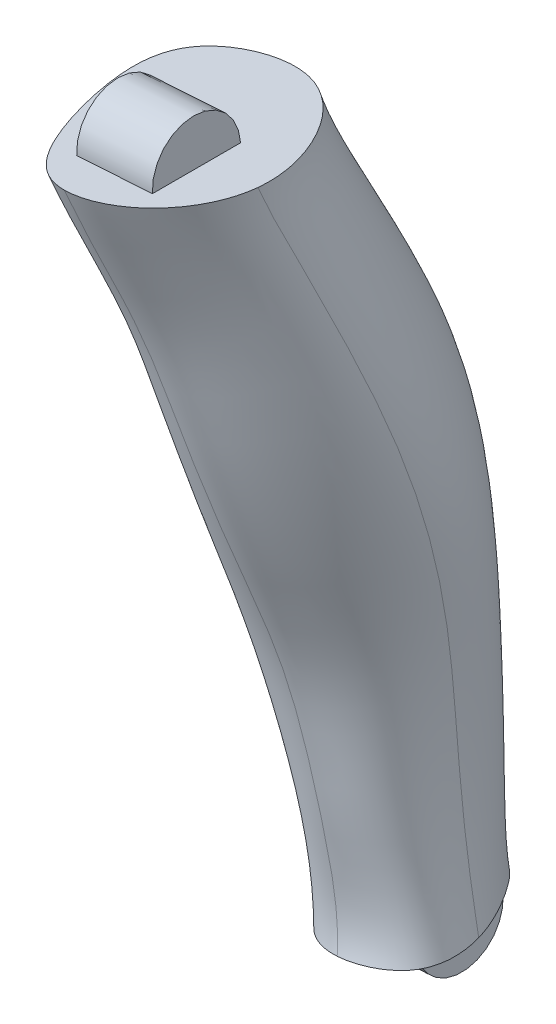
SolidWorks part; units mm, degrees
ref_plane "Front Plane" through (0, 0, 0) normal (0, 0, 1) x (1, 0, 0)
ref_plane "Top Plane" through (0, 0, 0) normal (0, 1, 0) x (1, 0, 0)
ref_plane "Right Plane" through (0, 0, 0) normal (1, 0, 0) x (0, 0, -1)
imported_body "Stock-Source-1"
ref_plane "Plane1" through (0, 0, 88.9) normal (0, 0, 1) x (1, 0, 0)
sketch "Sketch1" plane through (0, 0, 88.9) normal (0, 0, 1) x (1, 0, 0)
  line L0 (130.8768, 3248.3735) -> (174.4954, 3251.1744)
  line L1 (145.3171, 3249.3008) -> (116.4365, 3247.4462) construction
  line L2 (203.6736, 3253.0481) -> (145.3171, 3249.3008) construction
  line L3 (174.4954, 3251.1744) -> (172.8677, 3276.5222)
  line L4 (172.8677, 3276.5222) -> (129.2491, 3273.7213)
  line L5 (129.2491, 3273.7213) -> (130.8768, 3248.3735)
  dimension "D1" = 25.4
revolve "Revolve1" add sketch "Sketch1" angle 360 about L0
sketch "Sketch2" plane through (0, 0, 0) normal (0, 0, 1) x (1, 0, 0)
  line L0 (205.2259, 2860.8871) -> (236.8517, 2862.7863)
  line L1 (205.2259, 2860.8871) -> (206.7485, 2835.5328)
  line L2 (236.8517, 2862.7863) -> (238.3743, 2837.432)
  line L3 (206.7485, 2835.5328) -> (238.3743, 2837.432)
  line L4 (191.68, 2860.0737) -> (218.7719, 2861.7006) construction
  line L5 (218.7719, 2861.7006) -> (254.9316, 2863.8721) construction
  dimension "D1" = 25.4
revolve "Revolve2" add sketch "Sketch2" angle 360 about L0
